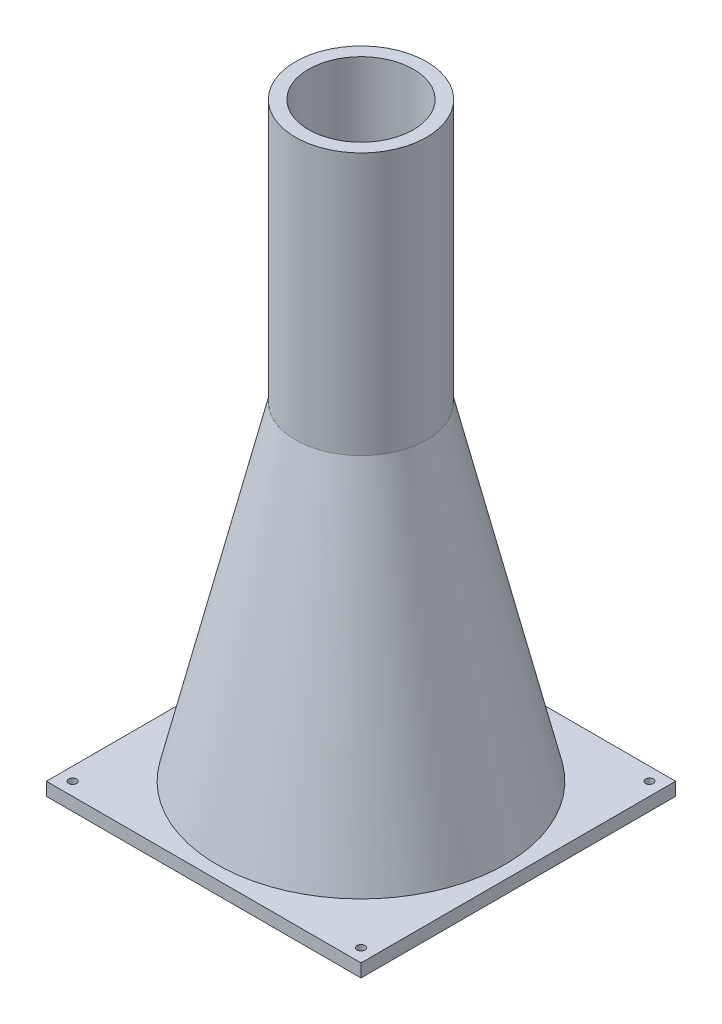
SolidWorks part; units mm, degrees
ref_plane "Alzado" through (0, 0, 0) normal (0, 0, 1) x (1, 0, 0)
ref_plane "Planta" through (0, 0, 0) normal (0, 1, 0) x (1, 0, 0)
ref_plane "Vista lateral" through (0, 0, 0) normal (1, 0, 0) x (0, 0, -1)
sketch "Croquis1" plane through (0, 0, 0) normal (0, 0, 1) x (1, 0, 0)
  line L0 (-25, 225.2129) -> (-25, 125.2129)
  line L1 (-25, 125.2129) -> (-55, 0)
  line L2 (0, 0) -> (0, 332.6087) construction
  line L3 (-55, 0) -> (-50, 0)
  line L4 (-50, 0) -> (-20, 125.2129)
  line L5 (-20, 125.2129) -> (-20, 225.2129)
  line L6 (-20, 225.2129) -> (-25, 225.2129)
  point P6 (-73.1328, 232.6087)
  point P10 (-92.8446, 0)
  point P11 (0, 0)
  point P12 (-77.9377, 332.6491)
  point P13 (-74.3208, 0)
  point P14 (-15, 137.6144)
  point P15 (-58.4267, 0)
  point P16 (-15, 105.826)
  point P17 (-48.3604, 0)
  point P18 (-60.0161, 0)
  point P19 (-20, 122.7798)
  point P20 (-20, 137.0846)
  point P21 (-20, 125.2129)
  dimension "D1" = 100
  dimension "D2" = 5
  dimension "D3" = 5
  dimension "D4" = 5
  dimension "D5" = 20
  dimension "D6" = 50
revolve "Revolución1" add sketch "Croquis1" angle 360 about L2
sketch "Croquis2" plane through (0, 0, 0) normal (0, -1, 0) x (1, 0, 0)
  line L1 (-60, -60) -> (60, -60)
  line L2 (-60, -60) -> (-60, 60)
  line L3 (-60, 60) -> (60, 60)
  line L4 (60, -60) -> (60, 60)
  line L5 (-60, -60) -> (60, 60) construction
  line L6 (-60, 60) -> (60, -60) construction
  point P0 (0, 0)
  dimension "D1" = 120
  dimension "D2" = 120
extrude "Saliente-Extruir1" add sketch "Croquis2" along normal blind 5
sketch "Croquis3" plane through (0, -5, 0) normal (0, -1, 0) x (1, 0, 0)
  line L0 (-60, 60) -> (-60, -60) construction
  line L1 (60, 60) -> (-60, 60) construction
  circle A0 centre (-55, 55) radius 1.5
  circle A1 centre (55, 55) radius 1.5
  circle A2 centre (55, -55) radius 1.5
  circle A3 centre (-55, -55) radius 1.5
  point P15 (0, 0)
  dimension "D1" = 5
  dimension "D2" = 3
  dimension "D3" = 5
  dimension "D4" = 4
extrude "Cortar-Extruir1" cut sketch "Croquis3" against normal blind 5
sketch "Croquis4" plane through (0, 0, 0) normal (0, 1, 0) x (1, 0, 0)
  circle A0 centre (0, 0) radius 50 construction
  circle A1 centre (0, 0) radius 50
extrude "Cortar-Extruir2" cut sketch "Croquis4" against normal blind 5
